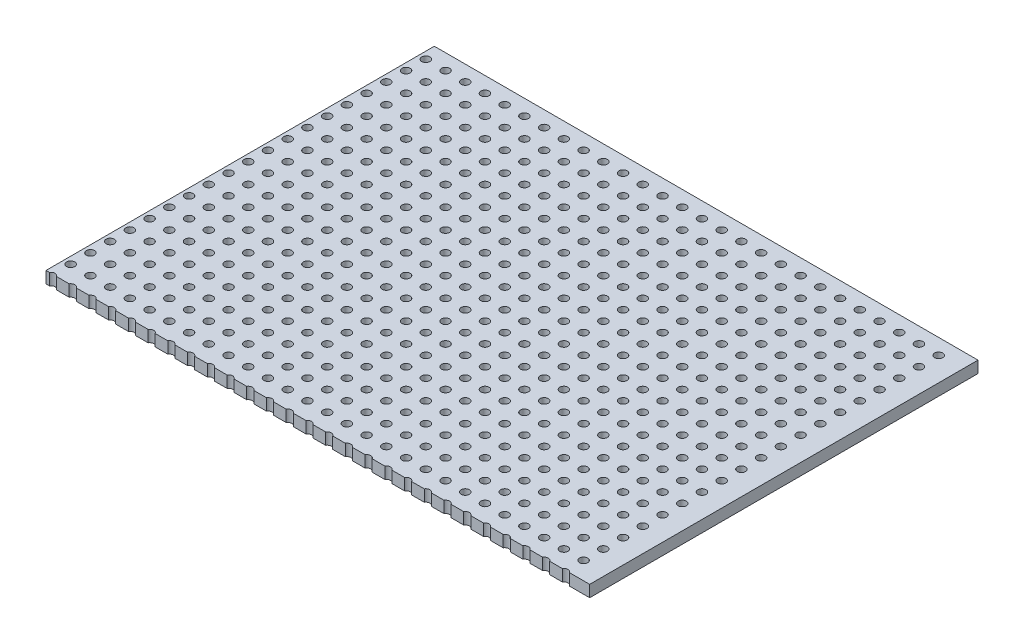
SolidWorks part; units mm, degrees
ref_plane "Front Plane" through (0, 0, 0) normal (0, 0, 1) x (1, 0, 0)
ref_plane "Top Plane" through (0, 0, 0) normal (0, 1, 0) x (1, 0, 0)
ref_plane "Right Plane" through (0, 0, 0) normal (1, 0, 0) x (0, 0, -1)
sketch "Sketch1" plane through (0, 0, 0) normal (0, 1, 0) x (1, 0, 0)
  line L1 (-80, 50) -> (80, 50)
  line L2 (-80, 50) -> (-80, -50)
  line L3 (-80, -50) -> (80, -50)
  line L4 (80, 50) -> (80, -50)
  line L5 (-80, 50) -> (80, -50) construction
  line L6 (-80, -50) -> (80, 50) construction
  point P0 (0, 0)
extrude "Extrude1" add sketch "Sketch1" along normal blind 1.5
hole_wizard "Ø1.05 (1.05) Diameter Hole1" positions "3DSketch1" profile "Sketch2" hole size "Ø1.05" standard "ISO"
sketch3d "3DSketch1"
  point P0 (-78, 1.5, -48)
sketch "Sketch2" plane through (-78, 1.5, -48) normal (1, 0, 0) x (0, 0, 1)
  line L0 (0, 0) -> (0, 1.5)
  line L1 (0, 1.5) -> (0.525, 1.5)
  line L2 (0.525, 1.5) -> (0.525, 0)
  line L5 (0.525, 0) -> (0, 0)
  line L11 (0, -6.35) -> (0, 107.95) construction
  dimension "Thru Hole Dia." = 1.05
  dimension "Thru Hole Depth" = 1.5
other "Fill Pattern1" parameters "D1"=2.54, "D2"=90, "D3"=1
sketch "Sketch3" plane through (0, 0, 0) normal (0, 1, 0) x (1, 0, 0)
  line L0 (-80, 50) -> (0, 50)
  line L1 (80, 50) -> (-80, 50) construction
  line L2 (0, 50) -> (0, -50)
  line L3 (-80, -50) -> (80, -50) construction
  line L4 (0, -50) -> (-80, -50)
  line L5 (-80, 50) -> (-80, -50) construction
  line L6 (-80, -50) -> (-80, 50)
  dimension "D1" = 80
extrude "Cut-Extrude3" cut sketch "Sketch3" along normal blind 10
sketch "Sketch4" plane through (0, 0, 0) normal (0, 1, 0) x (1, 0, 0)
  line L0 (0, -50) -> (0, 0)
  line L1 (0, 50) -> (0, -50) construction
  line L2 (0, 0) -> (80, 0)
  line L3 (80, -50) -> (80, 50) construction
  line L4 (80, 0) -> (80, -50)
  line L5 (80, -50) -> (0, -50)
extrude "Cut-Extrude4" cut sketch "Sketch4" along normal blind 10
sketch "Sketch5" plane through (0, 1.5, 0) normal (0, 1, 0) x (1, 0, 0)
  line L1 (80, 50) -> (0, 50) construction
  line L2 (10, 50) -> (10, 0)
  line L6 (0, 50) -> (10, 50)
  line L7 (0, 50) -> (0, 0)
  line L8 (0, 0) -> (10, 0)
extrude "Cut-Extrude5" cut sketch "Sketch5" against normal blind 10
